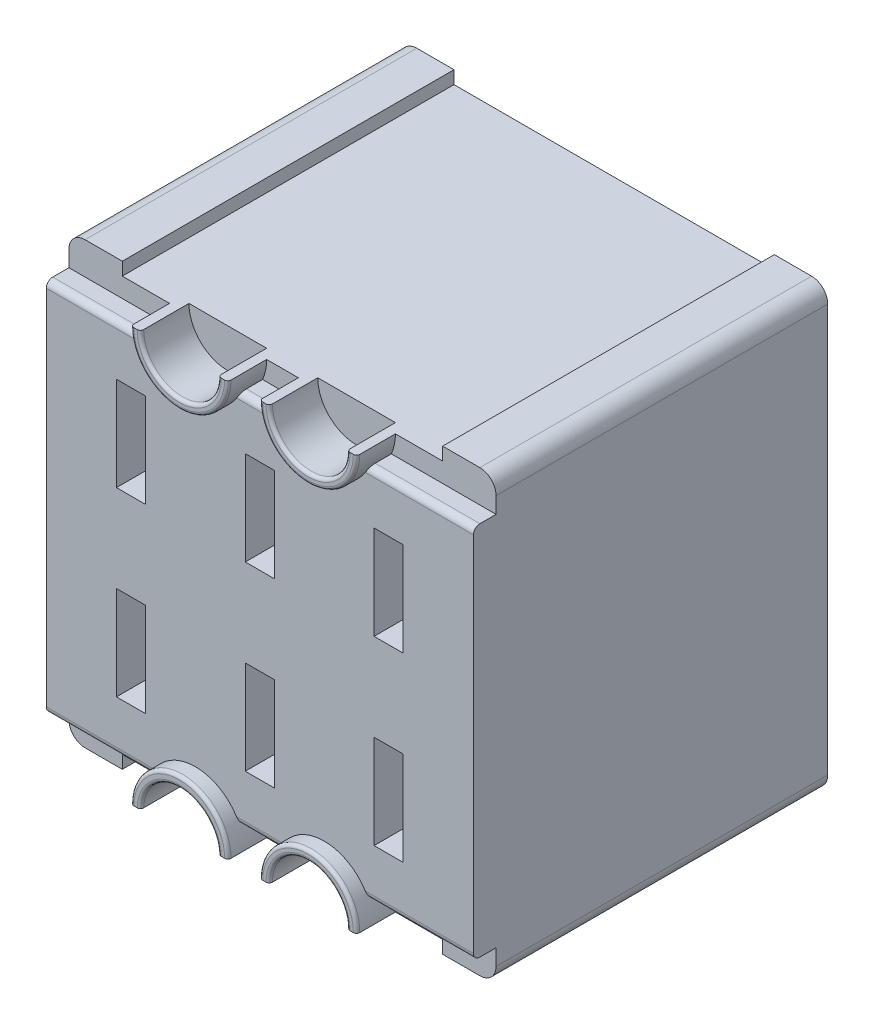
SolidWorks part; units mm, degrees
ref_plane "Plan de face" through (0, 0, 0) normal (0, 0, 1) x (1, 0, 0)
ref_plane "Plan de dessus" through (0, 0, 0) normal (0, 1, 0) x (1, 0, 0)
ref_plane "Plan de droite" through (0, 0, 0) normal (1, 0, 0) x (0, 0, -1)
sketch "Esquisse1" plane through (0, 0, 0) normal (0, 0, 1) x (1, 0, 0)
  line L1 (0, 0) -> (13.2, 0)
  line L2 (0, 0) -> (0, 13.6)
  line L3 (0, 13.6) -> (13.2, 13.6)
  line L4 (13.2, 0) -> (13.2, 13.6)
  dimension "D1" = 13.2
  dimension "D2" = 13.6
extrude "Boss.-Extru.1" add sketch "Esquisse1" against normal blind 11.45
sketch "Esquisse2" plane through (0, 0, 0) normal (0, 0, 1) x (1, 0, 0)
  line L0 (13.2, 13.6) -> (0, 13.6) construction
  line L1 (1.65, 13.6) -> (11.55, 13.6)
  line L2 (1.65, 13.6) -> (1.65, 13.2)
  line L3 (1.65, 13.2) -> (11.55, 13.2)
  line L4 (11.55, 13.6) -> (11.55, 13.2)
  line L5 (0, 0) -> (13.2, 0) construction
  line L6 (1.65, 0) -> (11.55, 0)
  line L7 (1.65, 0) -> (1.65, 0.4)
  line L8 (1.65, 0.4) -> (11.55, 0.4)
  line L9 (11.55, 0) -> (11.55, 0.4)
  line L10 (0, 13.6) -> (0, 0) construction
  dimension "D1" = 9.9
  dimension "D2" = 9.9
  dimension "D3" = 0.4
  dimension "D4" = 0.4
  dimension "D5" = 1.65
  dimension "D6" = 1.65
extrude "Enlèv. mat.-Extru.1" cut sketch "Esquisse2" against normal through all
sketch "Esquisse4" plane through (0, 0, 0) normal (0, 0, 1) x (1, 0, 0)
  line L0 (4.61, 8.0272) -> (4.61, -0.3354) construction
  line L1 (8.59, 8.0272) -> (8.59, -0.7448) construction
  line L2 (1.65, 13.2) -> (11.55, 13.2) construction
  line L3 (11.55, 0.4) -> (1.65, 0.4) construction
  line L4 (1.65, 13.6) -> (1.65, 13.2) construction
  line L5 (11.55, 13.2) -> (11.55, 13.6) construction
  line L6 (3.11, 13.2) -> (1.65, 13.2)
  line L7 (1.65, 13.2) -> (1.65, 13.6)
  line L8 (1.65, 13.6) -> (0, 13.6) construction
  line L9 (1.65, 13.6) -> (0, 13.6)
  line L10 (0, 13.6) -> (0, 0)
  line L11 (0, 0) -> (1.65, 0)
  line L12 (1.65, 0) -> (1.65, 0.4)
  line L13 (1.65, 0.4) -> (3.11, 0.4)
  line L14 (6.11, 0.4) -> (7.09, 0.4)
  line L15 (10.09, 0.4) -> (11.55, 0.4)
  line L16 (11.55, 0) -> (11.55, 0.4) construction
  line L17 (11.55, 0.4) -> (11.55, 0)
  line L18 (11.55, 0) -> (13.2, 0)
  line L19 (13.2, 0) -> (13.2, 13.6)
  line L20 (13.2, 13.6) -> (11.55, 13.6) construction
  line L21 (13.2, 0) -> (13.2, 13.6) construction
  line L22 (13.2, 13.6) -> (11.55, 13.6)
  line L23 (11.55, 13.6) -> (11.55, 13.2)
  line L24 (11.55, 13.2) -> (10.09, 13.2)
  line L25 (7.09, 13.2) -> (6.11, 13.2)
  arc A0 (3.11, 13.2) -> (6.11, 13.2) centre (4.61, 13.2) ccw
  arc A1 (7.09, 13.2) -> (10.09, 13.2) centre (8.59, 13.2) ccw
  arc A2 (6.11, 0.4) -> (3.11, 0.4) centre (4.61, 0.4) ccw
  arc A3 (10.09, 0.4) -> (7.09, 0.4) centre (8.59, 0.4) ccw
  point P20 (1.65, 13.4)
  dimension "D1" = 1.5
  dimension "D2" = 1.5
  dimension "D3" = 1.5
  dimension "D4" = 1.5
  dimension "D5" = 2.96
  dimension "D6" = 2.96
extrude "Enlèv. mat.-Extru.4" cut sketch "Esquisse4" against normal blind 0.5
sketch "Esquisse5" plane through (0, 0, 0) normal (0, 0, 1) x (1, 0, 0)
  line L0 (4.61, 7.3401) -> (4.61, -0.3939) construction
  line L1 (8.59, 7.3401) -> (8.59, -0.774) construction
  line L2 (1.65, 13.2) -> (1.65, 13.6) construction
  line L3 (11.55, 13.6) -> (11.55, 13.2) construction
  line L4 (3.11, 13.2) -> (6.11, 13.2) construction
  line L5 (7.09, 13.2) -> (10.09, 13.2) construction
  line L6 (6.11, 0.4) -> (3.11, 0.4) construction
  line L7 (10.09, 0.4) -> (7.09, 0.4) construction
  line L8 (3.41, 13.2) -> (5.81, 13.2)
  line L9 (7.39, 13.2) -> (9.79, 13.2)
  line L10 (3.4105, 0.4) -> (5.8095, 0.4)
  line L11 (7.39, 0.4) -> (9.79, 0.4)
  arc A0 (3.41, 13.2) -> (5.81, 13.2) centre (4.61, 13.2) ccw
  arc A1 (9.79, 13.2) -> (7.39, 13.2) centre (8.59, 13.2) cw
  arc A2 (5.8095, 0.4) -> (3.4105, 0.4) centre (4.61, 0.3663) ccw
  arc A3 (9.79, 0.4) -> (7.39, 0.4) centre (8.59, 0.4) ccw
  point P4 (1.65, 13.4)
  point P7 (11.55, 13.4)
  dimension "D3" = 1.2
  dimension "D4" = 1.2
  dimension "D5" = 1.2
  dimension "D6" = 1.2
  dimension "D1" = 2.96
  dimension "D2" = 2.96
extrude "Enlèv. mat.-Extru.5" cut sketch "Esquisse5" against normal blind 1.5
sketch "Esquisse6" plane through (0, 0, -0.5) normal (0, 0, 1) x (1, 0, 0)
  line L0 (4.61, 8.0711) -> (4.61, -1.0664) construction
  line L1 (8.59, 8.0711) -> (8.59, -1.0664) construction
  line L2 (1.65, 13.2) -> (1.65, 13.6) construction
  line L3 (11.55, 13.6) -> (11.55, 13.2) construction
  line L4 (5.81, 13.2) -> (3.41, 13.2) construction
  line L5 (1.8168, 12.6) -> (14.0433, 12.6) construction
  line L6 (3.11, 13.2) -> (1.65, 13.2) construction
  line L7 (3.11, 13.2) -> (1.65, 13.2)
  line L8 (1.65, 13.2) -> (1.65, 13.6)
  line L9 (1.65, 13.6) -> (0, 13.6)
  line L10 (0, 13.6) -> (0, 12.6)
  line L11 (0, 13.6) -> (0, 0) construction
  line L12 (0, 12.6) -> (3.2352, 12.6)
  line L13 (9.79, 13.2) -> (7.39, 13.2) construction
  line L14 (10.09, 13.2) -> (11.55, 13.2)
  line L15 (11.55, 13.2) -> (11.55, 13.6)
  line L16 (11.55, 13.6) -> (13.2, 13.6)
  line L17 (13.2, 13.6) -> (13.2, 12.6)
  line L18 (13.2, 0) -> (13.2, 13.6) construction
  line L19 (13.2, 12.6) -> (9.9648, 12.6)
  line L20 (7.09, 13.2) -> (6.11, 13.2) construction
  line L21 (6.11, 13.2) -> (7.09, 13.2)
  line L22 (5.9848, 12.6) -> (7.2152, 12.6)
  line L23 (-0.2493, 1) -> (14.1078, 1) construction
  line L24 (1.65, 0.4) -> (3.11, 0.4) construction
  line L25 (3.2352, 1) -> (0, 1)
  line L26 (0, 1) -> (0, 0)
  line L27 (0, 0) -> (1.65, 0)
  line L28 (1.65, 0) -> (1.65, 0.4)
  line L29 (1.65, 0.4) -> (3.11, 0.4)
  line L30 (6.11, 0.4) -> (5.8095, 0.4) construction
  line L31 (7.39, 0.4) -> (9.79, 0.4) construction
  line L32 (5.9848, 1) -> (7.2152, 1)
  line L33 (6.11, 0.4) -> (7.09, 0.4)
  line L34 (7.09, 0.4) -> (7.0787, 0.397)
  line L35 (9.9648, 1) -> (13.2, 1)
  line L36 (13.2, 1) -> (13.2, 0)
  line L37 (13.2, 0) -> (11.55, 0)
  line L38 (11.55, 0) -> (11.55, 0.4)
  line L39 (11.55, 0.4) -> (10.09, 0.4)
  arc A0 (3.11, 13.2) -> (3.2352, 12.6) centre (4.61, 13.2) ccw
  arc A2 (10.09, 13.2) -> (9.9648, 12.6) centre (8.59, 13.2) cw
  arc A3 (7.09, 13.2) -> (7.2152, 12.6) centre (8.59, 13.2) ccw
  arc A4 (7.09, 13.2) -> (10.09, 13.2) centre (8.59, 13.2) ccw construction
  arc A5 (7.09, 13.2) -> (10.09, 13.2) centre (8.59, 13.2) ccw construction
  arc A6 (6.11, 13.2) -> (5.9848, 12.6) centre (4.61, 13.2) cw
  arc A7 (3.11, 13.2) -> (6.11, 13.2) centre (4.61, 13.2) ccw construction
  arc A8 (3.11, 0.4) -> (3.2352, 1) centre (4.61, 0.4) cw
  arc A9 (5.9848, 1) -> (6.11, 0.4) centre (4.61, 0.4) cw
  arc A10 (7.2152, 1) -> (7.09, 0.4) centre (8.59, 0.4) ccw
  arc A11 (10.09, 0.4) -> (7.09, 0.4) centre (8.59, 0.4) ccw construction
  arc A12 (9.9648, 1) -> (10.09, 0.4) centre (8.59, 0.4) cw
  arc A13 (10.09, 0.4) -> (7.09, 0.4) centre (8.59, 0.4) ccw construction
  point P6 (11.55, 13.4)
  dimension "D4" = 0.6
  dimension "D5" = 1.5
  dimension "D6" = 1.5
  dimension "D1" = 2.96
  dimension "D2" = 2.96
  dimension "D3" = 0.6
extrude "Enlèv. mat.-Extru.7" cut sketch "Esquisse6" against normal blind 0.7 contours L12 M11 M7 M8 M9 M10 | L22 M7 M25 M26 | L19 M21 M22 M23 M24 M25 | L35 M17 M18 M19 M20 M21 | L32 M15 M16 M17 | L25 M15 M11 M12 M13 M14
fillet "Congé2" radius 0.5 4 edges at (13.2, 0, -6.325) (13.2, 13.6, -6.325) (0, 0, -6.325) (0, 13.6, -6.325)
fillet "Congé3" radius 0.1 8 edges at (4.61, 1.5663, 0) (4.61, 1.9, 0) (8.59, 1.9, 0) (8.59, 1.6, 0) (8.59, 11.7, 0) (8.59, 12, 0) (4.61, 12, 0) (4.61, 11.7, 0)
fillet "Congé4" radius 0.2 6 edges at (1.6176, 1, -0.5) (6.6, 1, -0.5) (11.5824, 1, -0.5) (11.5824, 12.6, -0.5) (6.6, 12.6, -0.5) (1.6176, 12.6, -0.5)
sketch "Esquisse7" plane through (0, 0, -0.5) normal (0, 0, 1) x (1, 0, 0)
  line L0 (-1.3241, 4) -> (15.0069, 4) construction
  line L1 (0.5, 0) -> (1.65, 0) construction
  line L2 (4.61, 7.8372) -> (4.61, -0.2778) construction
  line L3 (2.17, 5.45) -> (3.07, 5.45)
  line L4 (2.17, 5.45) -> (2.17, 2.55)
  line L5 (2.17, 2.55) -> (3.07, 2.55)
  line L6 (3.07, 5.45) -> (3.07, 2.55)
  line L7 (6.15, 5.45) -> (7.05, 5.45)
  line L8 (6.15, 5.45) -> (6.15, 2.55)
  line L9 (6.15, 2.55) -> (7.05, 2.55)
  line L10 (7.05, 5.45) -> (7.05, 2.55)
  line L11 (10.13, 5.45) -> (11.03, 5.45)
  line L12 (10.13, 5.45) -> (10.13, 2.55)
  line L13 (10.13, 2.55) -> (11.03, 2.55)
  line L14 (11.03, 5.45) -> (11.03, 2.55)
  line L15 (8.59, 7.8372) -> (8.59, -0.8625) construction
  line L16 (1.65, 13.2) -> (1.65, 13.6) construction
  line L17 (11.55, 13.6) -> (11.55, 13.2) construction
  line L18 (-3.1965, 6.8) -> (16.1361, 6.8) construction
  line L19 (11.03, 8.15) -> (11.03, 11.05)
  line L20 (10.13, 11.05) -> (11.03, 11.05)
  line L21 (10.13, 8.15) -> (10.13, 11.05)
  line L22 (10.13, 8.15) -> (11.03, 8.15)
  line L23 (7.05, 8.15) -> (7.05, 11.05)
  line L24 (6.15, 11.05) -> (7.05, 11.05)
  line L25 (6.15, 8.15) -> (6.15, 11.05)
  line L26 (6.15, 8.15) -> (7.05, 8.15)
  line L27 (3.07, 8.15) -> (3.07, 11.05)
  line L28 (2.17, 11.05) -> (3.07, 11.05)
  line L29 (2.17, 8.15) -> (2.17, 11.05)
  line L30 (2.17, 8.15) -> (3.07, 8.15)
  dimension "D1" = 4
  dimension "D2" = 1.45
  dimension "D3" = 1.45
  dimension "D4" = 1.45
  dimension "D5" = 0.9
  dimension "D6" = 0.9
  dimension "D7" = 0.9
  dimension "D8" = 2.9
  dimension "D9" = 2.9
  dimension "D10" = 2.9
  dimension "D11" = 2.96
  dimension "D12" = 2.96
  dimension "D13" = 1.54
  dimension "D14" = 1.54
  dimension "D15" = 1.54
  dimension "D16" = 6.8
extrude "Enlèv. mat.-Extru.8" cut sketch "Esquisse7" against normal through all
sketch "Esquisse8" plane through (0, 0, -11.45) normal (0, 0, -1) x (-1, 0, 0)
  line L0 (-13.2, 0.5) -> (-13.2, 13.1) construction
  line L1 (-11.55, 12.4) -> (-1.65, 12.4)
  line L2 (-11.55, 12.4) -> (-11.55, 1.2)
  line L3 (-11.55, 1.2) -> (-1.65, 1.2)
  line L4 (-1.65, 12.4) -> (-1.65, 1.2)
  line L5 (0, 13.1) -> (0, 0.5) construction
  line L6 (-1.65, 13.2) -> (-11.55, 13.2) construction
  line L7 (-11.55, 0.4) -> (-1.65, 0.4) construction
  dimension "D1" = 1.65
  dimension "D2" = 1.65
  dimension "D3" = 0.8
  dimension "D4" = 0.8
extrude "Enlèv. mat.-Extru.9" cut sketch "Esquisse8" against normal blind 0.5
